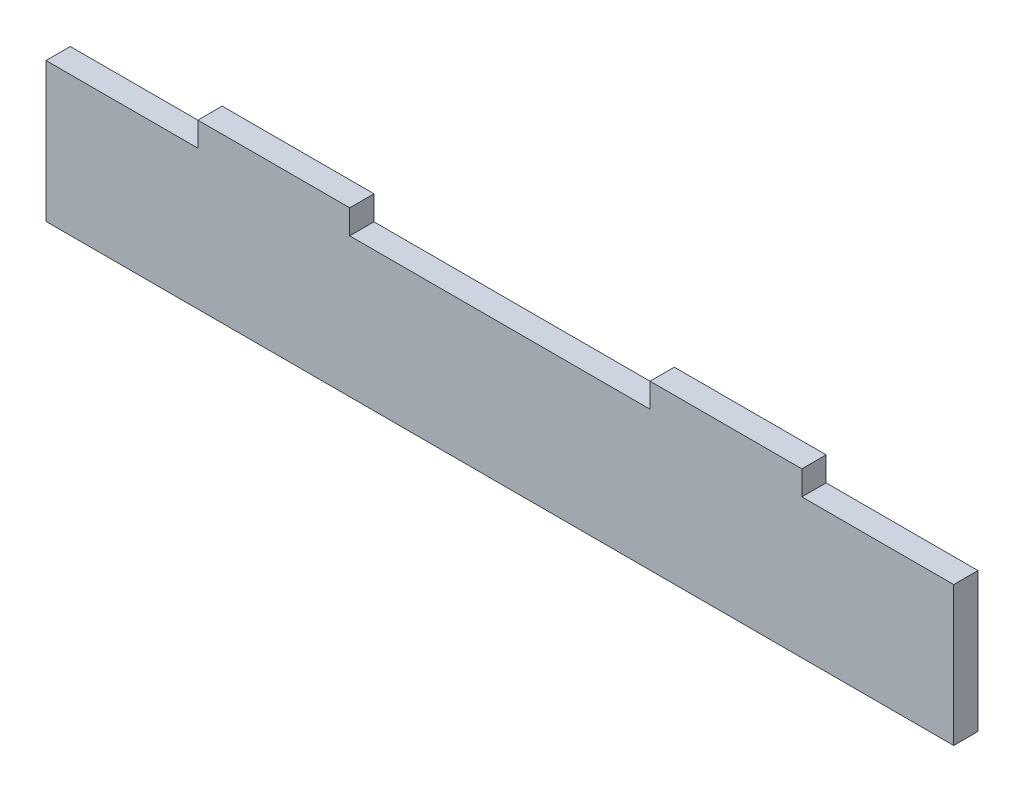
SolidWorks part; units mm, degrees
ref_plane "Front Plane" through (0, 0, 0) normal (0, 0, 1) x (1, 0, 0)
ref_plane "Top Plane" through (0, 0, 0) normal (0, 1, 0) x (1, 0, 0)
ref_plane "Right Plane" through (0, 0, 0) normal (1, 0, 0) x (0, 0, -1)
sketch "Sketch1" plane through (0, 0, 0) normal (0, 0, 1) x (1, 0, 0)
  line L0 (0, 91.8) -> (100, 91.8) construction
  line L1 (0, 0) -> (597.8, 0)
  line L2 (0, 0) -> (0, 91.8)
  line L3 (0, 91.8) -> (597.8, 91.8)
  line L4 (597.8, 0) -> (597.8, 91.8)
  line L5 (298.9, 0) -> (298.9, 223.8769) construction
  line L6 (100, 91.8) -> (200, 91.8)
  line L7 (100, 91.8) -> (100, 107.8)
  line L8 (100, 107.8) -> (200, 107.8)
  line L9 (200, 91.8) -> (200, 107.8)
  line L10 (397.8, 91.8) -> (397.8, 107.8)
  line L11 (497.8, 107.8) -> (397.8, 107.8)
  line L12 (497.8, 91.8) -> (497.8, 107.8)
  line L13 (497.8, 91.8) -> (397.8, 91.8)
extrude "Boss-Extrude1" add sketch "Sketch1" along normal blind 16 contours L3 L4 L1 L2 | L8 L9 L6 L7 | L11 L10 L13 L12
equation "\"thk\"= 16mm"
equation "\"D4@Sketch1\"=\"thk\""
equation "\"D1@Boss-Extrude1\"=\"thk\""
